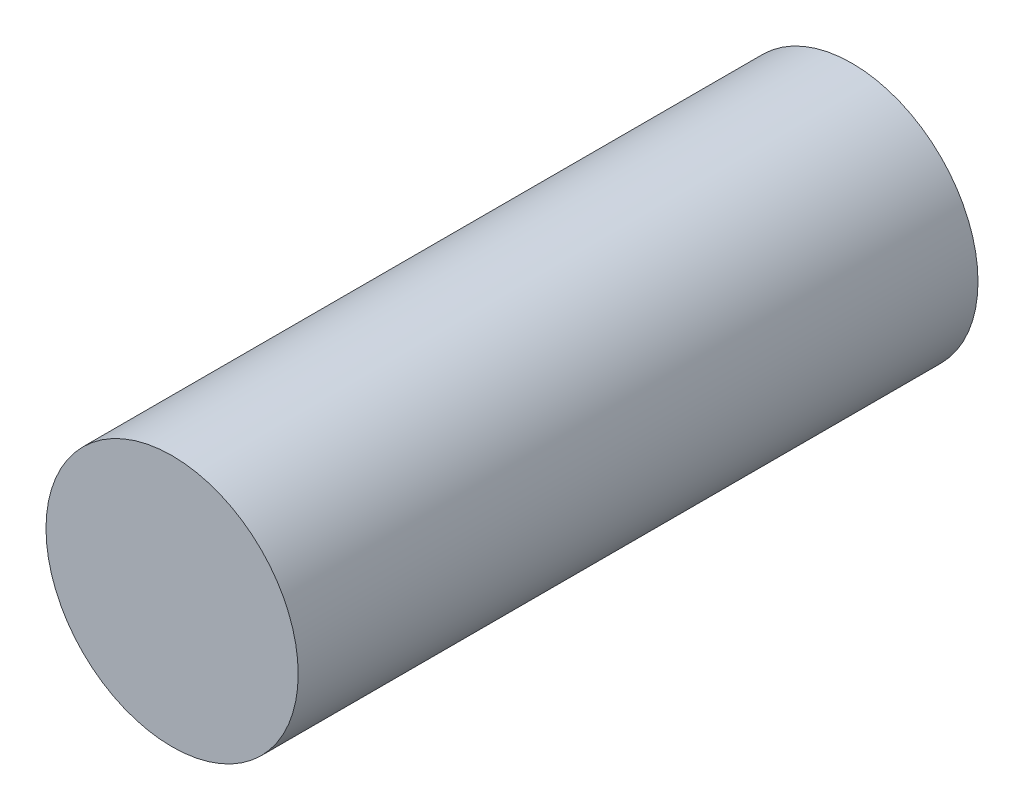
SolidWorks part; units mm, degrees
ref_plane "Ebene vorne" through (0, 0, 0) normal (0, 0, 1) x (1, 0, 0)
ref_plane "Ebene oben" through (0, 0, 0) normal (0, 1, 0) x (1, 0, 0)
ref_plane "Ebene rechts" through (0, 0, 0) normal (1, 0, 0) x (0, 0, -1)
sketch "Skizze1" plane through (0, 0, 0) normal (0, 0, 1) x (1, 0, 0)
  circle A0 centre (0, 0) radius 57.5
  dimension "D1" = 115
extrude "Linear austragen1" add sketch "Skizze1" along normal blind 310
